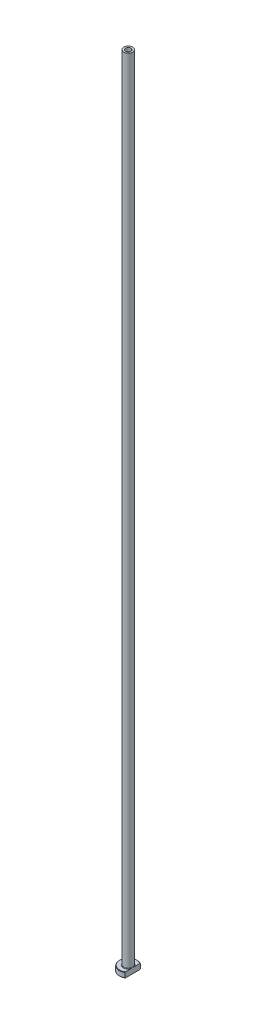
SolidWorks part; units mm, degrees
ref_plane "Front Plane" through (0, 0, 0) normal (0, 0, 1) x (1, 0, 0)
ref_plane "Top Plane" through (0, 0, 0) normal (0, 1, 0) x (1, 0, 0)
ref_plane "Right Plane" through (0, 0, 0) normal (1, 0, 0) x (0, 0, -1)
sketch "Sketch1" plane through (0, 0, 0) normal (0, 0, 1) x (1, 0, 0)
  line L0 (-1.5, 450) -> (-2.5, 450)
  line L1 (-2.5, 450) -> (-2.5, 3)
  line L2 (-2.5, 3) -> (-5, 3)
  line L3 (-5, 3) -> (-5, 0)
  line L4 (4.125, 0) -> (-4.125, 0) construction
  line L5 (-5, 0) -> (-1.75, 0)
  line L6 (-1.5, 405) -> (-1.5, 450)
  line L7 (0, 92.1877) -> (0, -15.5353) construction
  line L8 (0, -5.5) -> (0, 5.5) construction
  line L9 (-1.5, 405) -> (-1.75, 393)
  line L10 (-1.75, 393) -> (-1.75, 0)
  dimension "D1" = 0.25
  dimension "ID" = 3
  dimension "OD" = 5
  dimension "L" = 450
  dimension "H" = 10
  dimension "T" = 3
  dimension "N" = 45
  dimension "D2" = 12
  dimension "L-N" = 405
revolve "Revolve1" add sketch "Sketch1" angle 360 about L7
fillet "Fillet1" radius 0.3 1 edges at (0, 3, 2.5)
chamfer "Chamfer1" distance 0.2 angle 45 2 edges at (0, 3, 5) (0, 0, 5)
sketch "Sketch2" plane through (0, 0, 0) normal (0, -1, 0) x (1, 0, 0)
  line L0 (2.5, 4.3301) -> (2.5, -4.3301)
  circle A0 centre (0, 0) radius 5 construction
  arc A1 (2.5, 4.3301) -> (2.5, -4.3301) centre (0, 0) cw
  circle A2 centre (0, 0) radius 2.5 construction
extrude "Cut-Extrude1" cut sketch "Sketch2" against normal through all
chamfer "Chamfer2" distance 0.5 angle 45 1 edges at (0, 0, 1.75)
